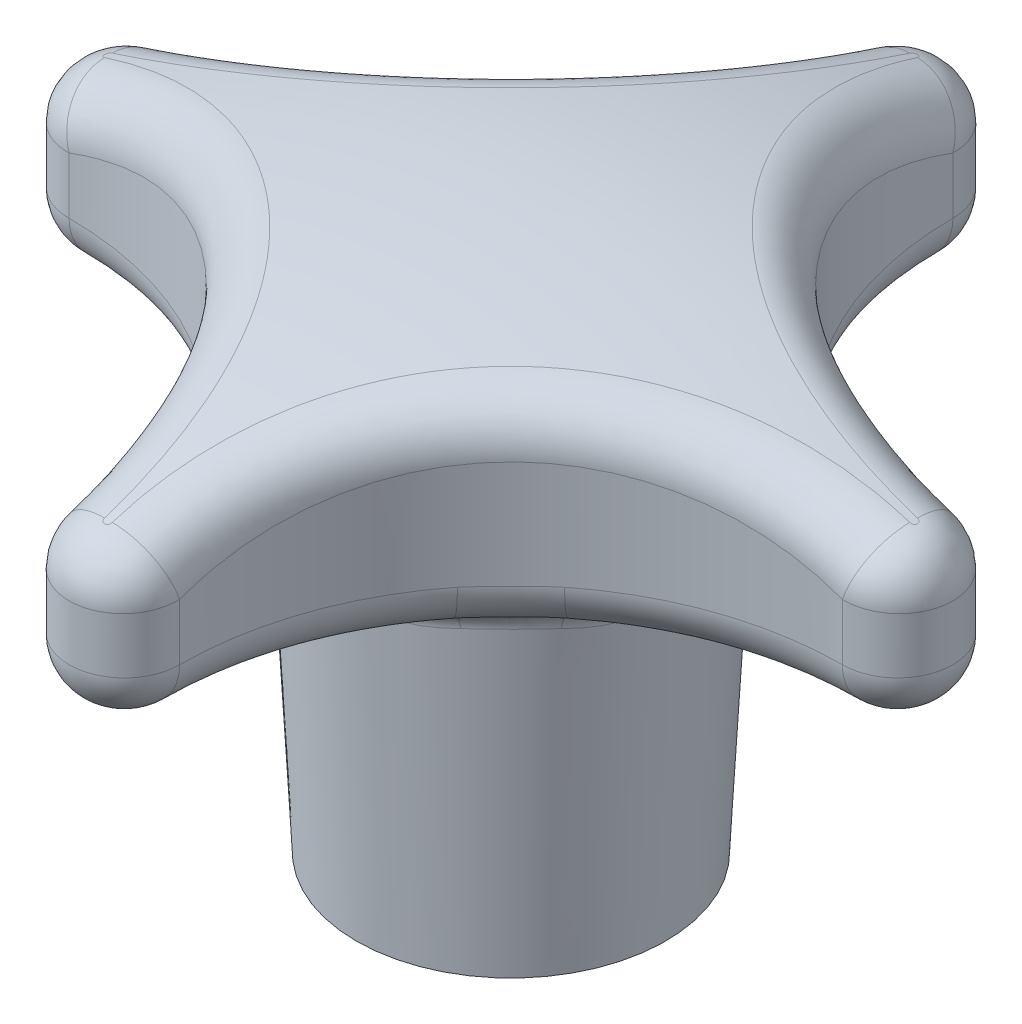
SolidWorks part; units mm, degrees
ref_plane "Front Plane" through (0, 0, 0) normal (0, 0, 1) x (1, 0, 0)
ref_plane "Top Plane" through (0, 0, 0) normal (0, 1, 0) x (1, 0, 0)
ref_plane "Right Plane" through (0, 0, 0) normal (1, 0, 0) x (0, 0, -1)
sketch "Sketch1" plane through (0, 0, 0) normal (0, 1, 0) x (1, 0, 0)
  circle A0 centre (0, 0) radius 7
  dimension "D1" = 14
extrude "Extrude1" add sketch "Sketch1" against normal blind 15
draft "Draft1" type of draft neutral plane draft angle 3 faces to draft 1 parameters "D1"=3
sketch "Sketch2" plane through (0, 0, 0) normal (0, 0, 1) x (1, 0, 0)
  line L0 (0, 0) -> (-20, 0)
  line L1 (-20, 0) -> (-20, 6.5)
  line L2 (0, 0) -> (0, 50000) construction
  line L3 (0, 10) -> (20.2547, 10) construction
  line L4 (0, 0) -> (0, 10)
  arc A0 (0, 10) -> (-20, 6.5) centre (0, -48.8929) ccw
revolve "Revolve1" add sketch "Sketch2" angle 360 about L2
sketch "Sketch4" plane through (0, 0, 0) normal (0, 1, 0) x (1, 0, 0)
  line L0 (0, 0) -> (-50000, 0) construction
  line L1 (0, 0) -> (0, 50000) construction
  line L2 (-17.5, 2.5) -> (-45.9117, 2.5) construction
  line L3 (-2.5, 17.5) -> (-2.5, 40.3224) construction
  arc A0 (0, 20) -> (-2.5, 17.5) centre (0, 17.5) ccw
  arc A1 (-17.5, 2.5) -> (-20, 0) centre (-17.5, 0) ccw
  circle A2 centre (0, 0) radius 20 construction
  arc A3 (-17.5, 2.5) -> (-2.5, 17.5) centre (-17.5, 17.5) ccw
  arc A4 (0, 20) -> (-20, 0) centre (-20, 20) ccw
  point P9 (0, 20)
  point P10 (-20, 0)
  point P13 (-2.5, 17.5)
  point P14 (-17.5, 2.5)
extrude "Extrude3" cut sketch "Sketch4" along normal through all
pattern_circular "CirPattern1" count 4 over 360 about axis through (0, 0, 0) along (0, 1, 0) of "Extrude3"
fillet "Fillet2" radius 2.3333 16 edges at (0, 0, 20) (6.8934, 0, 6.8934) (20, 0, 0) (6.8934, 0, -6.8934) (0, 0, -20) (-6.8934, 0, -6.8934) (-20, 0, 0) (-0.0002, 6.5, 20) (8.4075, 9.1301, 5.57) (20, 6.5, 0.0002) (5.57, 9.1301, -8.4075) (0.0002, 6.5, -20) (-8.4075, 9.1301, -5.57) (-20, 6.5, 0.0002) (-6.8934, 0, 6.8934) (-5.57, 9.1301, 8.4075)
fillet "Fillet3" radius 1.1667 8 edges at (-5.5056, 0, -5.5056) (0, 0, -7.7861) (5.5056, 0, -5.5056) (7.7861, 0, 0) (5.5056, 0, 5.5056) (0, 0, 7.7861) (-5.5056, 0, 5.5056) (-7.7861, 0, 0)
sketch "Sketch6" plane through (0, -15, 0) normal (0, -1, 0) x (1, 0, 0)
  circle A0 centre (0, 0) radius 4
  dimension "D1" = 8
extrude "Extrude5" cut sketch "Sketch6" against normal blind 18
sketch "Sketch7" plane through (0, 0, 0) normal (0, 0, 1) x (1, 0, 0)
  line L0 (0, 3) -> (4, 3)
  line L1 (4, -15) -> (4, 3) construction
  line L2 (4, 3) -> (0, 5.3094)
  line L3 (0, 5.3094) -> (0, 3)
  line L4 (-4, -15) -> (4, -15) construction
revolve "Cut-Revolve1" cut sketch "Sketch7" angle 360 about L3
sketch "Sketch8" [suppressed] plane through (0, -24, 0) normal (0, -1, 0) x (1, 0, 0)
  circle A0 centre (0, 0) radius 6
  dimension "D1" = 8
extrude "Extrude6" [suppressed] cut sketch "Sketch8" against normal blind 13
sketch "Sketch9" [suppressed] plane through (0, -4, 0) normal (0, -1, 0) x (1, 0, 0)
  circle A0 centre (0, 0) radius 6.5
  dimension "D1" = 8.4
extrude "Extrude7" [suppressed] cut sketch "Sketch9" against normal through all
sketch "Sketch10" [suppressed] plane through (0, -24, 0) normal (0, -1, 0) x (1, 0, 0)
  circle A0 centre (0, 0) radius 6
extrude "Extrude8" [suppressed] cut sketch "Sketch10" against normal blind 15
sketch "Sketch11" [suppressed] plane through (0, 0, 0) normal (0, 0, 1) x (1, 0, 0)
  line L0 (5.1, 7.0555) -> (5.1, -2)
  line L1 (0, 0) -> (0, -5.4531) construction
  line L2 (5.1, 7.0555) -> (0, 10)
  line L3 (0, 10) -> (0, -2)
  line L4 (-6, -2) -> (6, -2) construction
  line L5 (5.1, -2) -> (0, -2)
revolve "Cut-Revolve2" [suppressed] cut sketch "Sketch11" angle 360 about L3
equation "\"D2@Sketch2\" = \"D1@Sketch2\"*.65"
equation "\"D1@Sketch4\" = (\"D3@Sketch2\"*2)/8"
equation "\"D2@Sketch4\" =( \"D3@Sketch2\"*2)/8"
equation "\"D1@Sketch7\" = \"D1@Extrude5\""
equation "\"D1@Fillet3\" = \"D1@Fillet2\"/2"
equation "\"D2@Sketch11\" = \"D1@Sketch10\""
